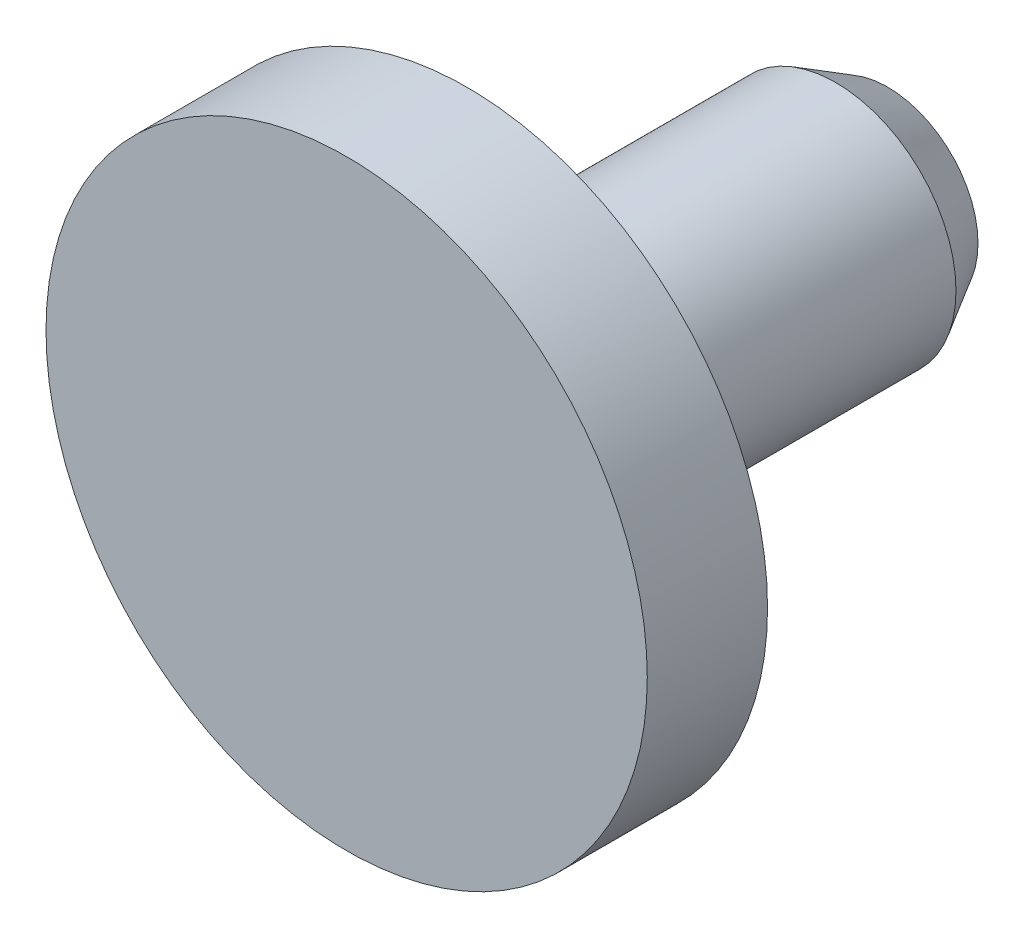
SolidWorks part; units mm, degrees
ref_plane "Alzado" through (0, 0, 0) normal (0, 0, 1) x (1, 0, 0)
ref_plane "Planta" through (0, 0, 0) normal (0, 1, 0) x (1, 0, 0)
ref_plane "Vista lateral" through (0, 0, 0) normal (1, 0, 0) x (0, 0, -1)
sketch "Croquis1" plane through (0, 0, 0) normal (0, 0, 1) x (1, 0, 0)
  circle A0 centre (0, 0) radius 5
  dimension "D1" = 10
extrude "Saliente-Extruir1" add sketch "Croquis1" along normal blind 2
sketch "Croquis2" plane through (0, 0, 0) normal (0, 0, 1) x (1, 0, 0)
  circle A0 centre (0, 0) radius 2
  dimension "D1" = 4
extrude "Saliente-Extruir2" add sketch "Croquis2" against normal blind 7
chamfer "Chaflán1" distance 0.5 angle 60 1 edges at (2, 0, -7)
